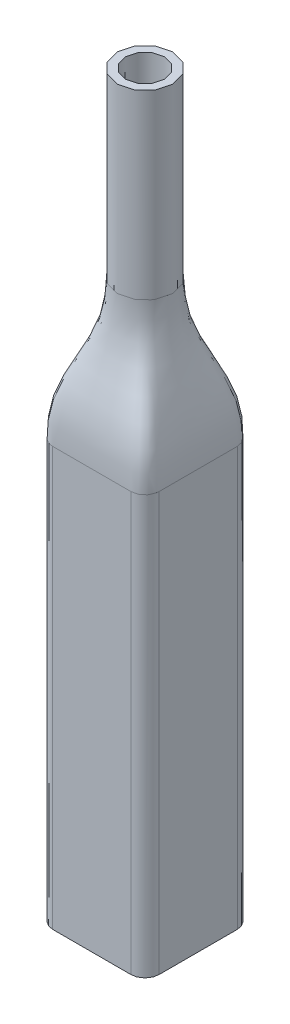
SolidWorks part; units mm, degrees
ref_plane "Front Plane" through (0, 0, 0) normal (0, 0, 1) x (1, 0, 0)
ref_plane "Top Plane" through (0, 0, 0) normal (0, 1, 0) x (1, 0, 0)
ref_plane "Right Plane" through (0, 0, 0) normal (1, 0, 0) x (0, 0, -1)
sketch "Sketch1" plane through (0, 0, 0) normal (0, 1, 0) x (1, 0, 0)
  line L1 (-19.05, -19.05) -> (19.05, -19.05)
  line L2 (-19.05, -19.05) -> (-19.05, 19.05)
  line L3 (-19.05, 19.05) -> (19.05, 19.05)
  line L4 (19.05, -19.05) -> (19.05, 19.05)
  line L5 (0, 19.05) -> (0, -19.05) construction
  line L6 (-19.05, 0) -> (19.05, 0) construction
  point P0 (0, 0)
  dimension "D1" = 38.1
extrude "Boss-Extrude1" add sketch "Sketch1" along normal blind 150
fillet "Fillet1" radius 5 4 edges at (19.05, 75, 19.05) (-19.05, 75, -19.05) (19.05, 75, -19.05) (-19.05, 75, 19.05)
ref_plane "Plane1" through (0, 265, 0) normal (0, 1, 0) x (1, 0, 0)
sketch "Sketch2" plane through (0, 265, 0) normal (0, 1, 0) x (1, 0, 0)
  circle A0 centre (0, 0) radius 10
  dimension "D1" = 20
extrude "Boss-Extrude2" add sketch "Sketch2" against normal blind 65 separate body
loft "Loft1" add
shell "Shell1" thickness 3
